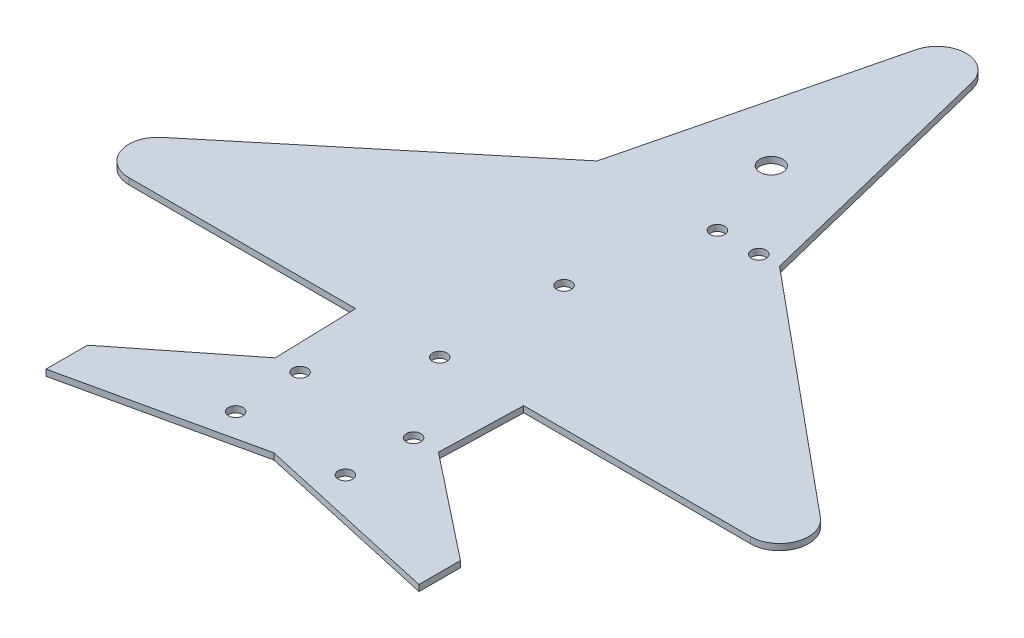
SolidWorks part; units mm, degrees
ref_plane "Front Plane" through (0, 0, 0) normal (0, 0, 1) x (1, 0, 0)
ref_plane "Top Plane" through (0, 0, 0) normal (0, 1, 0) x (1, 0, 0)
ref_plane "Right Plane" through (0, 0, 0) normal (1, 0, 0) x (0, 0, -1)
sketch "Sketch2" plane through (0, 0, 0) normal (0, 1, 0) x (1, 0, 0)
  line L0 (0, 0) -> (0, 167) construction
  line L1 (0, 0) -> (45, -10)
  line L2 (45, -10) -> (45, 0)
  line L3 (45, 0) -> (19.6972, 20)
  line L4 (19.6972, 20) -> (20.2729, 40)
  line L5 (20.2729, 40) -> (75, 40)
  line L6 (0, 0) -> (45, 0) construction
  line L7 (19.6972, 20) -> (19, -4.2222) construction
  line L8 (20.2729, 40) -> (22, 100) construction
  line L9 (22, 100) -> (79.4659, 52.3904)
  line L10 (22, 100) -> (6.7965, 161.6754)
  line L11 (13.6947, 20) -> (13.2342, 4) construction
  line L12 (0, 0) -> (-45, -10)
  line L13 (-45, -10) -> (-45, 0)
  line L14 (-45, 0) -> (-19.6972, 20)
  line L15 (-19.6972, 20) -> (-20.2729, 40)
  line L16 (-20.2729, 40) -> (-75, 40)
  line L17 (-22, 100) -> (-79.4659, 52.3904)
  line L18 (-22, 100) -> (-6.7965, 161.6754)
  line L19 (-20.2729, 40) -> (0, 40) construction
  line L20 (22, 100) -> (0, 100) construction
  line L21 (-19.6972, 20) -> (19.6972, 20) construction
  arc A0 (75, 40) -> (79.4659, 52.3904) centre (75, 47) ccw
  arc A1 (6.7965, 161.6754) -> (-6.7965, 161.6754) centre (0, 160) ccw
  circle A2 centre (13.6947, 20) radius 1.75
  circle A3 centre (13.2342, 4) radius 1.75
  circle A4 centre (-13.6947, 20) radius 1.75
  circle A5 centre (-13.2342, 4) radius 1.75
  arc A6 (-75, 40) -> (-79.4659, 52.3904) centre (-75, 47) cw
  circle A7 centre (0, 40) radius 1.75
  circle A8 centre (0, 70) radius 1.75
  circle A9 centre (0, 120) radius 2.75
  circle A10 centre (7, 100) radius 1.75
  circle A11 centre (17, 100) radius 1.75
  dimension "D8" = 7
  dimension "D11" = 7
  dimension "D13" = 3.5
  dimension "D15" = 14
  dimension "D16" = 30
  dimension "D17" = 20
  dimension "D18" = 5.5
  dimension "D19" = 7
  dimension "D20" = 10
  dimension "D1" = 10
  dimension "D2" = 45
  dimension "D3" = 19
  dimension "D4" = 20
  dimension "D5" = 22
  dimension "D6" = 60
  dimension "D7" = 20
  dimension "D9" = 30
  dimension "D10" = 60
  dimension "D12" = 6
extrude "Boss-Extrude1" add sketch "Sketch2" along normal blind 1.5
